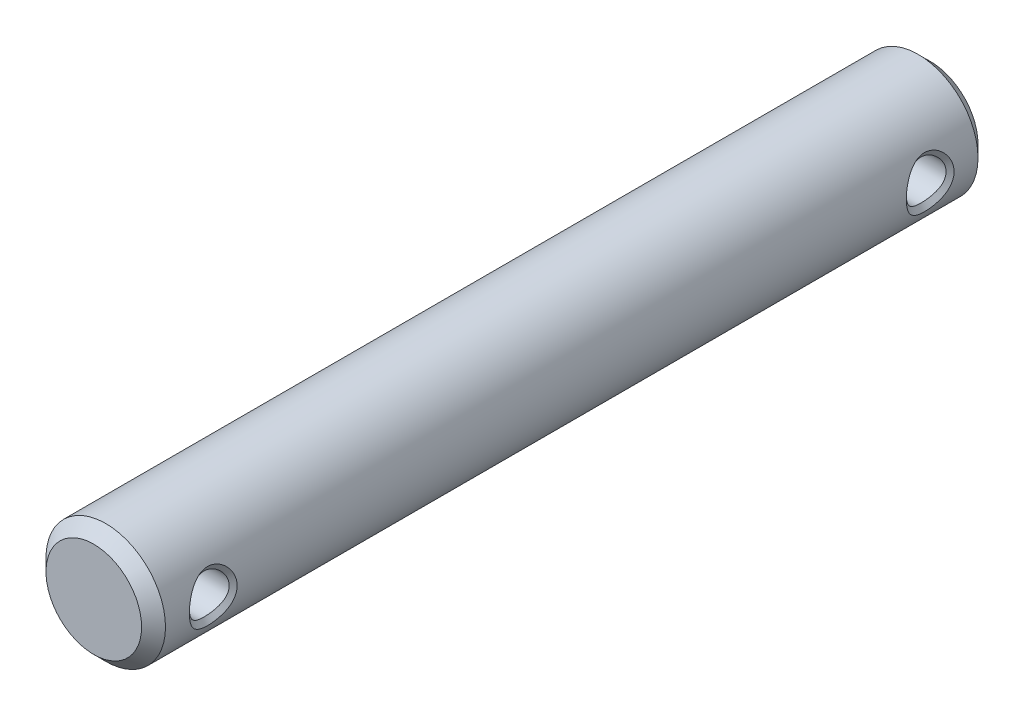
SolidWorks part; units mm, degrees
ref_plane "Plan de face" through (0, 0, 0) normal (0, 0, 1) x (1, 0, 0)
ref_plane "Plan de dessus" through (0, 0, 0) normal (0, 1, 0) x (1, 0, 0)
ref_plane "Plan de droite" through (0, 0, 0) normal (1, 0, 0) x (0, 0, -1)
sketch "Esquisse1" plane through (0, 0, 0) normal (0, 0, 1) x (1, 0, 0)
  circle A0 centre (0, 0) radius 15
  dimension "D1" = 30
extrude "Extrusion1" add sketch "Esquisse1" along normal blind 210
chamfer "Chanfrein1" distance 3 angle 45 2 edges at (15, 0, 210) (15, 0, 0)
sketch "Esquisse2" plane through (0, 0, 0) normal (1, 0, 0) x (0, 0, -1)
  line L0 (0, -12) -> (0, 12) construction
  line L1 (-210, 12) -> (-210, -12) construction
  circle A0 centre (-15, 0) radius 5
  circle A1 centre (-195, 0) radius 5
  dimension "D1" = 10
  dimension "D2" = 10
  dimension "D3" = 15
  dimension "D4" = 15
extrude "Enlèv. mat.-Extru.1" cut sketch "Esquisse2" against normal mid plane 198
chamfer "Chanfrein2" distance 1 angle 45 4 edges at (-14.9759, 0.8497, 190.0727) (14.9759, 0.8497, 199.9273) (-14.9759, 0.8497, 10.0727) (14.9759, 0.8497, 19.9273)
